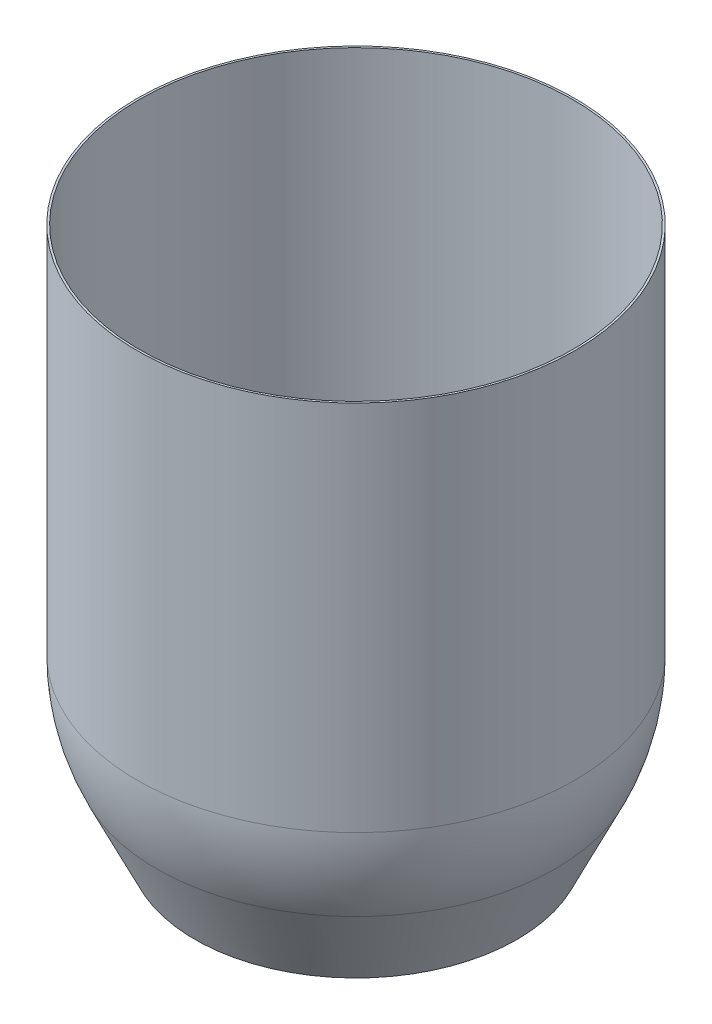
SolidWorks part; units mm, degrees
ref_plane "Plan de face" through (0, 0, 0) normal (0, 0, 1) x (1, 0, 0)
ref_plane "Plan de dessus" through (0, 0, 0) normal (0, 1, 0) x (1, 0, 0)
ref_plane "Plan de droite" through (0, 0, 0) normal (1, 0, 0) x (0, 0, -1)
sketch "Esquisse1" plane through (0, 0, 0) normal (0, 0, 1) x (1, 0, 0)
  line L0 (0, 67.4781) -> (0, -79.331) construction
  line L1 (0, 67.4781) -> (0, -214.697) construction
  line L2 (-108, 57.0806) -> (-108, -128.3742)
  line L3 (-79.9971, -210.9194) -> (0, -210.9194)
  line L4 (-79.9971, -210.9194) -> (-98.826, -171.2835)
  line L5 (-108.5, 57.0806) -> (-108.5, -128.3742)
  line L6 (-79.681, -210.4194) -> (-98.3744, -171.069)
  line L7 (-79.681, -210.4194) -> (0, -210.4194)
  arc A0 (-98.826, -171.2835) -> (-108.5, -128.3742) centre (-8.5, -128.3742) cw
  arc A1 (-98.3744, -171.069) -> (-108, -128.3742) centre (-8.5, -128.3742) cw
  point P12 (-108.5, -150.9194)
  dimension "D7" = 100
  dimension "D1" = 108.5
  dimension "D2" = 268
  dimension "D3" = 0.5
  dimension "D5" = 25.41
  dimension "D6" = 60
revolve "Révol.-Mince2" add sketch "Esquisse1" angle 360 about L1
sketch "Esquisse2" plane through (0, -211.4194, 0) normal (0, -1, 0) x (1, 0, 0)
  circle A0 centre (0, 0) radius 74
  dimension "D1" = 148
extrude "Enlèv. mat.-Extru.1" cut sketch "Esquisse2" against normal blind 10
chamfer "Chanfrein1" distance 0.75 angle 45 1 edges at (74, -210.4194, 0)
